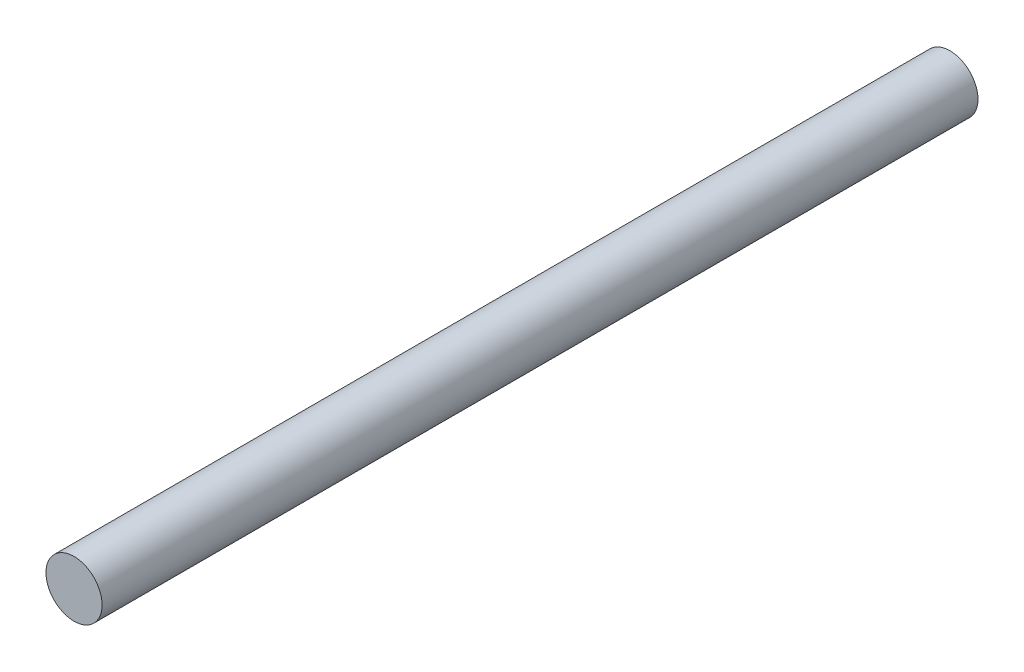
SolidWorks part; units mm, degrees
ref_plane "Front Plane" through (0, 0, 0) normal (0, 0, 1) x (1, 0, 0)
ref_plane "Top Plane" through (0, 0, 0) normal (0, 1, 0) x (1, 0, 0)
ref_plane "Right Plane" through (0, 0, 0) normal (1, 0, 0) x (0, 0, -1)
sketch "Sketch1" plane through (0, 0, 0) normal (0, 0, 1) x (1, 0, 0)
  circle A0 centre (0, 0) radius 3.175
  dimension "D1" = 6.35
extrude "Boss-Extrude1" add sketch "Sketch1" along normal blind 99.06
